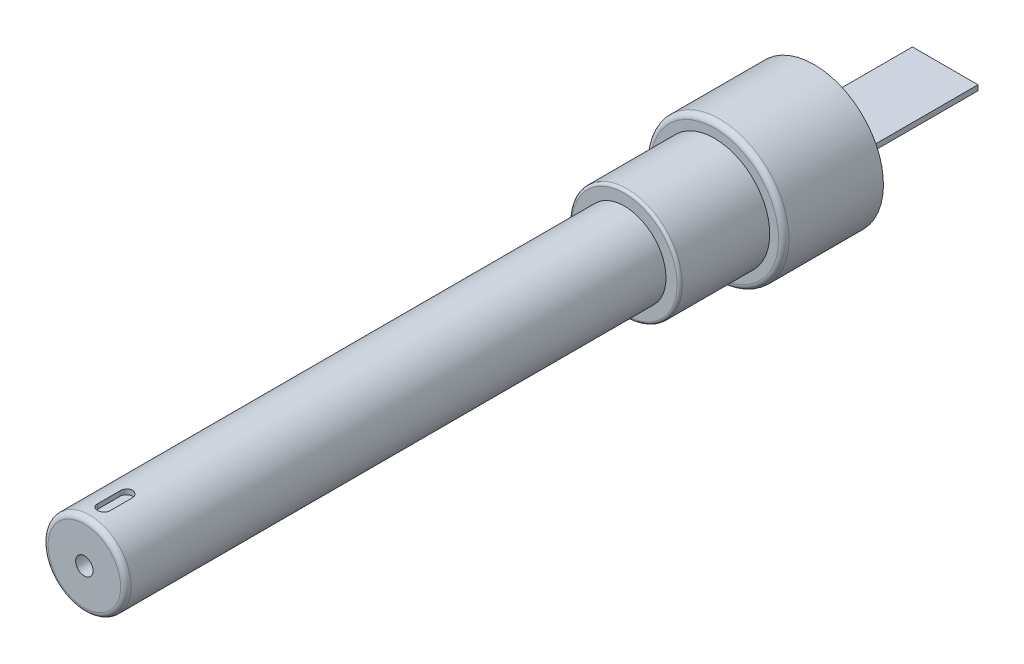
SolidWorks part; units mm, degrees
ref_plane "Front Plane" through (0, 0, 0) normal (0, 0, 1) x (1, 0, 0)
ref_plane "Top Plane" through (0, 0, 0) normal (0, 1, 0) x (1, 0, 0)
ref_plane "Right Plane" through (0, 0, 0) normal (1, 0, 0) x (0, 0, -1)
sketch "Sketch1" plane through (0, 0, 0) normal (1, 0, 0) x (0, 0, -1)
  line L0 (0, 0) -> (50.7666, 0) construction
  line L1 (0, 1.27) -> (9.525, 1.27)
  line L3 (0, 1.27) -> (0, 5.2705)
  line L4 (0.762, 6.0325) -> (78.486, 6.0325)
  line L5 (78.486, 5.5245) -> (78.486, 6.0325)
  line L6 (9.525, 5.5245) -> (78.486, 5.5245)
  line L7 (9.525, 5.5245) -> (9.525, 1.27)
  arc A0 (0.762, 6.0325) -> (0, 5.2705) centre (0.762, 5.2705) ccw
  point P9 (0, 6.0325)
  dimension "D5" = 0.762
  dimension "D1" = 12.065
  dimension "D2" = 9.525
  dimension "D3" = 0.508
  dimension "D4" = 78.486
  dimension "D6" = 2.54
revolve "sensor body" add sketch "Sketch1" angle 360 about L0
ref_plane "Plane1" through (0, 6.0325, 0) normal (0, 1, 0) x (1, 0, 0)
sketch "Sketch2" plane through (0, 6.0325, 0) normal (0, 1, 0) x (1, 0, 0)
  line L0 (0, 0) -> (0, 30.6145) construction
  line L1 (0, 2.794) -> (0, 6.096) construction
  line L2 (-0.889, 2.794) -> (-0.889, 6.096)
  line L3 (0.889, 2.794) -> (0.889, 6.096)
  line L4 (-5.2705, 0) -> (5.2705, 0) construction
  arc A0 (-0.889, 2.794) -> (0.889, 2.794) centre (0, 2.794) ccw
  arc A1 (0.889, 6.096) -> (-0.889, 6.096) centre (0, 6.096) ccw
  point P5 (0, 4.445)
  dimension "D1" = 1.778
  dimension "D2" = 3.302
  dimension "D3" = 4.445
extrude "isfet " cut sketch "Sketch2" against normal blind 0.762
sketch "Sketch5" plane through (0, 0, 0) normal (1, 0, 0) x (0, 0, -1)
  line L0 (116.8084, 0) -> (78.486, 0) construction
  line L1 (78.486, -6.0325) -> (78.486, 6.0325) construction
  line L2 (91.567, 8.0264) -> (91.567, 9.3091)
  line L3 (78.486, 0) -> (90.6001, 0)
  line L4 (78.486, 0) -> (78.486, 7.6454)
  line L5 (78.867, 8.0264) -> (91.567, 8.0264)
  line L7 (92.329, 10.0711) -> (106.045, 10.0711)
  line L8 (106.045, 10.0711) -> (106.045, 8.8011)
  line L9 (106.045, 8.8011) -> (99.695, 8.8011)
  line L10 (99.695, 8.8011) -> (99.695, 0)
  line L11 (99.695, 0) -> (90.6001, 0)
  arc A0 (92.329, 10.0711) -> (91.567, 9.3091) centre (92.329, 9.3091) ccw
  arc A1 (78.867, 8.0264) -> (78.486, 7.6454) centre (78.867, 7.6454) ccw
  dimension "D1" = 0.762
  dimension "D2" = 0.381
  dimension "D3" = 12.7
  dimension "D4" = 16.0528
  dimension "D5" = 20.1422
  dimension "D6" = 14.478
  dimension "D7" = 1.27
  dimension "D8" = 6.35
revolve "base" add sketch "Sketch5" angle 360 about L0
sketch "Sketch6" plane through (0, 0, -99.695) normal (0, 0, -1) x (-1, 0, 0)
  line L1 (-4.7625, 0.381) -> (4.7625, 0.381)
  line L2 (-4.7625, 0.381) -> (-4.7625, -0.381)
  line L3 (-4.7625, -0.381) -> (4.7625, -0.381)
  line L4 (4.7625, 0.381) -> (4.7625, -0.381)
  dimension "D1" = 0.762
  dimension "D2" = 0.381
  dimension "D3" = 9.525
  dimension "D4" = 4.7625
extrude "pcb" add sketch "Sketch6" along normal blind 25.4
